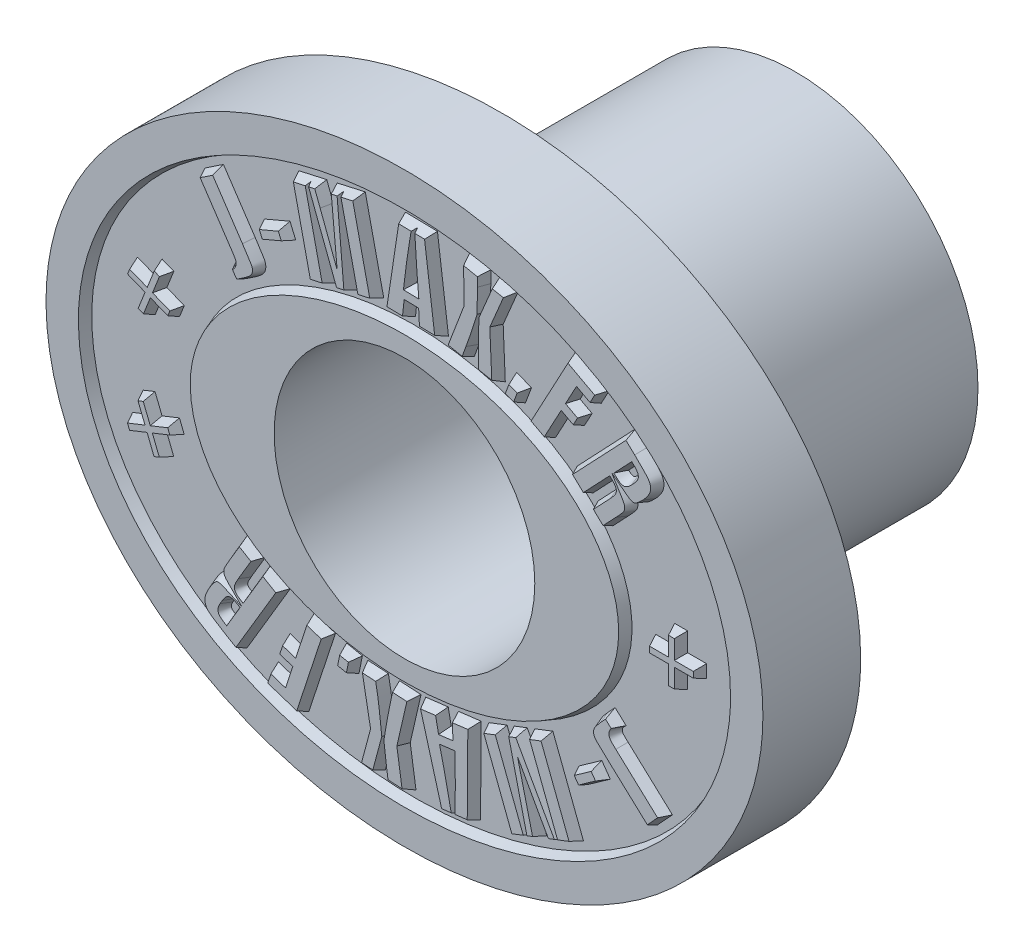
SolidWorks part; units mm, degrees
ref_plane "Plan de face" through (0, 0, 0) normal (0, 0, 1) x (1, 0, 0)
ref_plane "Plan de dessus" through (0, 0, 0) normal (0, 1, 0) x (1, 0, 0)
ref_plane "Plan de droite" through (0, 0, 0) normal (1, 0, 0) x (0, 0, -1)
sketch "Esquisse1" plane through (0, 0, 0) normal (0, 0, 1) x (1, 0, 0)
  circle A0 centre (0, 0) radius 2.8
  circle A1 centre (0, 0) radius 2
  dimension "D1" = 5.6
  dimension "D2" = 4
extrude "Boss.-Extru.1" add sketch "Esquisse1" along normal mid plane 6
sketch "Esquisse2" plane through (0, 0, 3) normal (0, 0, 1) x (1, 0, 0)
  circle A0 centre (0, 0) radius 2.8
  ellipse E0 centre (0, 0) end of major axis (5.5, 0) minor radius 4.5
  dimension "D1" = 5.6
extrude "Boss.-Extru.2" add sketch "Esquisse2" against normal blind 1.5
sketch "Esquisse4" plane through (0, 0, 3) normal (0, 0, 1) x (1, 0, 0)
  ellipse E0 centre (0, 0) end of major axis (-3.2866, 0) minor radius 2.3076
  ellipse E1 centre (0, 0) end of major axis (5.003, 0) minor radius 3.9731
extrude "Enlèv. mat.-Extru.3" cut sketch "Esquisse4" against normal blind 0.15 draft 20
sketch "Esquisse3" plane through (0, 0, 2.85) normal (0, 0, 1) x (1, 0, 0)
  ellipse E0 centre (0, 0) end of major axis (-3.5, 0) minor radius 2.5 construction
  text T0 "+  J-MAX.FR  +  J-MAX.FR  +" font "Impact" height 1.3
extrude "Boss.-Extru.4" add sketch "Esquisse3" along normal blind 0.15 draft 20
